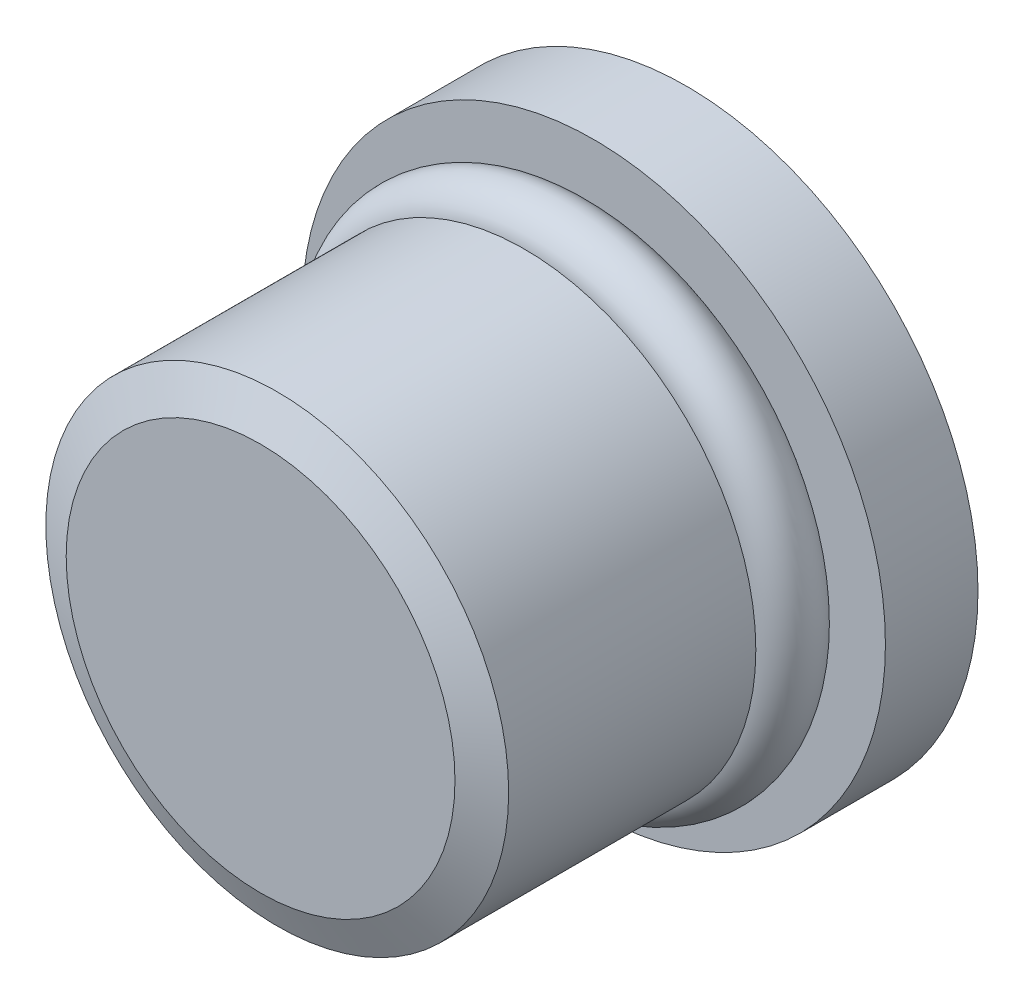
SolidWorks part; units mm, degrees
ref_plane "Front Plane" through (0, 0, 0) normal (0, 0, 1) x (1, 0, 0)
ref_plane "Top Plane" through (0, 0, 0) normal (0, 1, 0) x (1, 0, 0)
ref_plane "Right Plane" through (0, 0, 0) normal (1, 0, 0) x (0, 0, -1)
sketch3d "Ref Origin1"
  line L0 (0, 0, 0) -> (2.54, 0, 0)
  line L1 (0, 0, 0) -> (0, 0, -2.54)
  point P0 (0, 0, 0)
ref_plane "Plane1" through (0, 0, 0) normal (1, 0, 0) x (0, 0, -1)
sketch "Sketch1" plane through (0, 0, 0) normal (1, 0, 0) x (0, 0, -1)
  line L0 (-11.684, 5.334) -> (-11.2268, 6.35)
  line L1 (-11.2268, 6.35) -> (-4.445, 6.35)
  line L2 (-4.445, 6.35) -> (-4.445, 5.4102)
  line L3 (-4.445, 5.4102) -> (-2.54, 5.4102)
  line L4 (-2.54, 5.4102) -> (-2.54, 8.001)
  line L5 (-2.54, 8.001) -> (0, 8.001)
  line L6 (0, 8.001) -> (0, 0)
  line L7 (0, 0) -> (-11.684, 0)
  line L8 (-11.684, 0) -> (-11.684, 5.334)
  line L9 (-12.2682, 0) -> (0.5842, 0) construction
  dimension "D1" = 9.144
revolve "Revolve1" add sketch "Sketch1" angle 360 about L9
ref_plane "Plane2" through (0, 0, 0) normal (1, 0, 0) x (0, 0, -1)
ref_plane "Plane3" through (0, 0, 0) normal (1, 0, 0) x (0, 0, -1)
sketch "Sketch3" plane through (0, 0, 0) normal (1, 0, 0) x (0, 0, -1)
  line L0 (-4.4069, 0) -> (-2.4511, 0) construction
  circle A0 centre (-3.429, 6.096) radius 0.889
  dimension "D1" = 1.778
revolve "Revolve3" add sketch "Sketch3" angle 360 about L0
sketch "Sketch4" plane through (0, 0, 0) normal (0, 0, -1) x (-1, 0, 0)
  line L0 (-2.3812, -1.3748) -> (-2.3812, 1.3748)
  line L1 (-2.3812, 1.3748) -> (0, 2.7496)
  line L2 (0, 2.7496) -> (2.3812, 1.3748)
  line L3 (2.3812, 1.3748) -> (2.3812, -1.3748)
  line L4 (2.3812, -1.3748) -> (0, -2.7496)
  line L5 (0, -2.7496) -> (-2.3812, -1.3748)
  line L6 (3.2742, -1.8904) -> (-3.2742, 1.8904) construction
  dimension "D1" = 4.7625
extrude "Cut-Extrude1" cut sketch "Sketch4" against normal blind 4.6736
sketch3d "Ref Origin2"
  line L0 (0, 0, 2.54) -> (2.54, 0, 2.54)
  line L1 (0, 0, 2.54) -> (0, 2.54, 2.54)
  point P0 (0, 0, 2.54)
